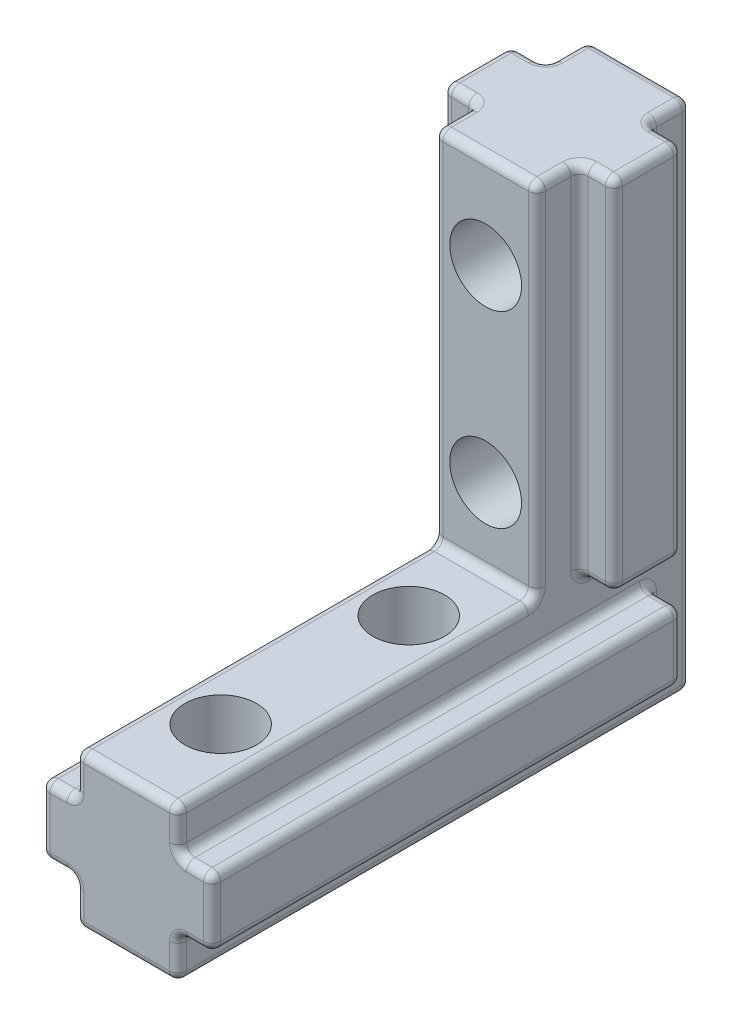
SolidWorks part; units mm, degrees
ref_plane "正面" through (0, 0, 0) normal (0, 0, 1) x (1, 0, 0)
ref_plane "平面" through (0, 0, 0) normal (0, 1, 0) x (1, 0, 0)
ref_plane "右側面" through (0, 0, 0) normal (1, 0, 0) x (0, 0, -1)
sketch "ｽｹｯﾁ1" plane through (0, 0, 0) normal (0, 0, 1) x (1, 0, 0)
  line L12 (-6, 0) -> (0, 0)
  line L13 (2, 6.5) -> (0, 6.5)
  line L14 (0, 2.5) -> (2, 2.5)
  line L15 (-6, 6.5) -> (-8, 6.5)
  line L16 (-8, 2.5) -> (-6, 2.5)
  line L17 (-8, 2.5) -> (-8, 6.5)
  line L18 (0, 9) -> (0, 6.5)
  line L19 (-6, 9) -> (-6, 6.5)
  line L20 (0, 9) -> (-6, 9)
  line L21 (2, 2.5) -> (2, 6.5)
  line L22 (0, 2.5) -> (0, 0)
  line L23 (-6, 2.5) -> (-6, 0)
extrude "押し出し1" add sketch "ｽｹｯﾁ1" along normal blind 30
sketch "ｽｹｯﾁ2" plane through (0, 9, 0) normal (0, -1, 0) x (1, 0, 0)
  line L12 (-6, 0) -> (0, 0)
  line L13 (2, 6.5) -> (0, 6.5)
  line L14 (0, 2.5) -> (2, 2.5)
  line L15 (-6, 6.5) -> (-8, 6.5)
  line L16 (-8, 2.5) -> (-6, 2.5)
  line L17 (-8, 2.5) -> (-8, 6.5)
  line L18 (0, 9) -> (0, 6.5)
  line L19 (-6, 9) -> (-6, 6.5)
  line L20 (0, 9) -> (-6, 9)
  line L21 (2, 2.5) -> (2, 6.5)
  line L22 (0, 2.5) -> (0, 0)
  line L23 (-6, 2.5) -> (-6, 0)
extrude "押し出し2" add sketch "ｽｹｯﾁ2" against normal blind 21
hole_wizard "M5x0.8 ねじ穴1" positions "3Dｽｹｯﾁ1" profile "ｽｹｯﾁ4" tap size "M5x0.8" standard "JIS"
sketch3d "3Dｽｹｯﾁ1"
  line L0 (-6, 9, 30) -> (-6, 9, 9) construction
  line L1 (0, 9, 30) -> (-6, 9, 30) construction
  line L3 (-6, 30, 9) -> (-6, 9, 9) construction
  line L4 (0, 30, 9) -> (-6, 30, 9) construction
  point P20 (-3, 24.5, 9)
  point P22 (-3, 13.5, 9)
  point P24 (-3, 9, 13.5)
  point P26 (-3, 9, 24.5)
  dimension "D1" = 3
  dimension "D3" = 5.5
  dimension "D2" = 3
  dimension "D4" = 11
  dimension "D5" = 3
  dimension "D6" = 3
  dimension "D7" = 5.5
  dimension "D8" = 11
sketch "ｽｹｯﾁ4" plane through (-3, 24.5, 9) normal (1, 0, 0) x (0, -1, 0)
  line L0 (0, 0) -> (0, 9)
  line L1 (0, 9) -> (2.1, 9)
  line L2 (2.1, 9) -> (2.1, 0)
  line L5 (2.1, 0) -> (0, 0)
  line L11 (0, -6.35) -> (0, 107.95) construction
  dimension "次ｻｰﾌｪｽまでのねじ下穴ﾄﾞﾘﾙの直径" = 4.2
  dimension "次ｻｰﾌｪｽまでのねじ下穴ﾄﾞﾘﾙの深さ" = 9
sketch "ｽｹｯﾁ5" plane through (0, 6.5, 0) normal (0, 1, 0) x (1, 0, 0)
  line L1 (-8, 0) -> (-6, 0)
  line L2 (-8, 0) -> (-8, -2.5)
  line L3 (-8, -2.5) -> (-6, -2.5)
  line L4 (-6, 0) -> (-6, -2.5)
  line L5 (0, -2.5) -> (2, -2.5)
  line L6 (0, -2.5) -> (0, 0)
  line L7 (0, 0) -> (2, 0)
  line L8 (2, -2.5) -> (2, 0)
extrude "押し出し3" cut sketch "ｽｹｯﾁ5" against normal through all
fillet "ﾌｨﾚｯﾄ1" radius 0.5 26 edges at (-3, 0, 0) (0, 6.5, 16.25) (2, 6.5, 16.25) (2, 2.5, 16.25) (0, 2.5, 16.25) (0, 0, 15) (-6, 0, 15) (-6, 2.5, 16.25) (-8, 2.5, 16.25) (-8, 6.5, 16.25) (-6, 6.5, 16.25) (-8, 19.5, 6.5) (-8, 19.5, 2.5) (-6, 15, 0) (0, 15, 0) (2, 19.5, 2.5) (2, 19.5, 6.5)
fillet "ﾌｨﾚｯﾄ2" radius 0.5 80 edges at (-0.1464, 30, 8.8536) (0, 30, 7.75) (0.1464, 30, 6.6464) (1, 30, 6.5) (1.8536, 30, 6.3536) (2, 30, 4.5) (1.8536, 30, 2.6464) (1, 30, 2.5) (0.1464, 30, 2.3536) (0, 30, 1.25) (-0.1464, 30, 0.1464) (-3, 30, 0) (-5.8536, 30, 0.1464) (-6, 30, 1.25) (-6.1464, 30, 2.3536) (-7, 30, 2.5) (-7.8536, 30, 2.6464) (-8, 30, 4.5) (-7.8536, 30, 6.3536) (-7, 30, 6.5) (-6.1464, 30, 6.6464) (-6, 30, 7.75) (-5.8536, 30, 8.8536) (-7.8536, 6.3536, 30) (-7, 6.5, 30) (-6.1464, 6.6464, 30) (-6, 7.75, 30) (-5.8536, 8.8536, 30) (-3, 9, 30) (-0.1464, 8.8536, 30) (0, 7.75, 30) (0.1464, 6.6464, 30) (1, 6.5, 30) (1.8536, 6.3536, 30) (2, 4.5, 30) (1.8536, 2.6464, 30) (1, 2.5, 30) (0.1464, 2.3536, 30) (0, 1.25, 30) (-0.1464, 0.1464, 30) (-3, 0, 30) (-5.8536, 0.1464, 30) (-6, 1.25, 30) (-6.1464, 2.3536, 30) (-7, 2.5, 30) (-7.8536, 2.6464, 30) (-3, 30, 9) (-8, 4.5, 30) (-6.1464, 6.6464, 2.5) (-7, 6.5, 2.5) (-7.8536, 6.3536, 2.5) (-8, 4.5, 2.5) (-7.8536, 2.6464, 2.5) (-6.1464, 2.3536, 2.5) (-6.1464, 9, 6.6464) (-7.8536, 9, 6.3536) (-8, 9, 4.5) (-7.8536, 9, 2.6464) (-6.1464, 9, 2.3536) (0.1464, 9, 2.3536) (0.1464, 9, 6.6464) (1.8536, 9, 6.3536) (2, 9, 4.5) (1.8536, 9, 2.6464) (0.1464, 2.3536, 2.5) (0.1464, 6.6464, 2.5) (1, 6.5, 2.5) (1.8536, 6.3536, 2.5) (2, 4.5, 2.5) (1.8536, 2.6464, 2.5) (0, 4.5, 2.5) (-6, 4.5, 2.5) (-7, 2.5, 2.5) (1, 2.5, 2.5)
